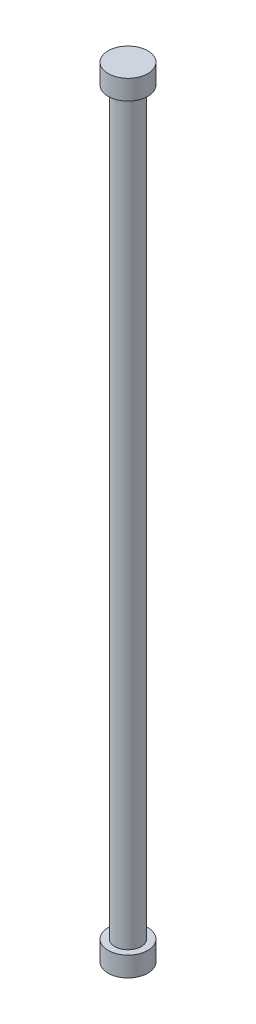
SolidWorks part; units mm, degrees
ref_plane "Front Plane" through (0, 0, 0) normal (1, 0, 0) x (0, 1, 0)
ref_plane "Top Plane" through (0, 0, 0) normal (0, 0, 1) x (0, 1, 0)
ref_plane "Right Plane" through (0, 0, 0) normal (0, 1, 0) x (-1, 0, 0)
sketch "Sketch1" plane through (0, 0, 0) normal (0, 1, 0) x (-1, 0, 0)
  circle A0 centre (0, 0) radius 15
extrude "Boss-Extrude1" add sketch "Sketch1" along normal blind 15
sketch "Sketch2" plane through (0, 15, 0) normal (0, 1, 0) x (-1, 0, 0)
  circle A0 centre (0, 0) radius 10
extrude "Boss-Extrude2" add sketch "Sketch2" along normal blind 560.5
sketch "Sketch3" plane through (0, 575.5, 0) normal (0, 1, 0) x (-1, 0, 0)
  circle A0 centre (0, 0) radius 15
extrude "Boss-Extrude3" add sketch "Sketch3" along normal blind 15
